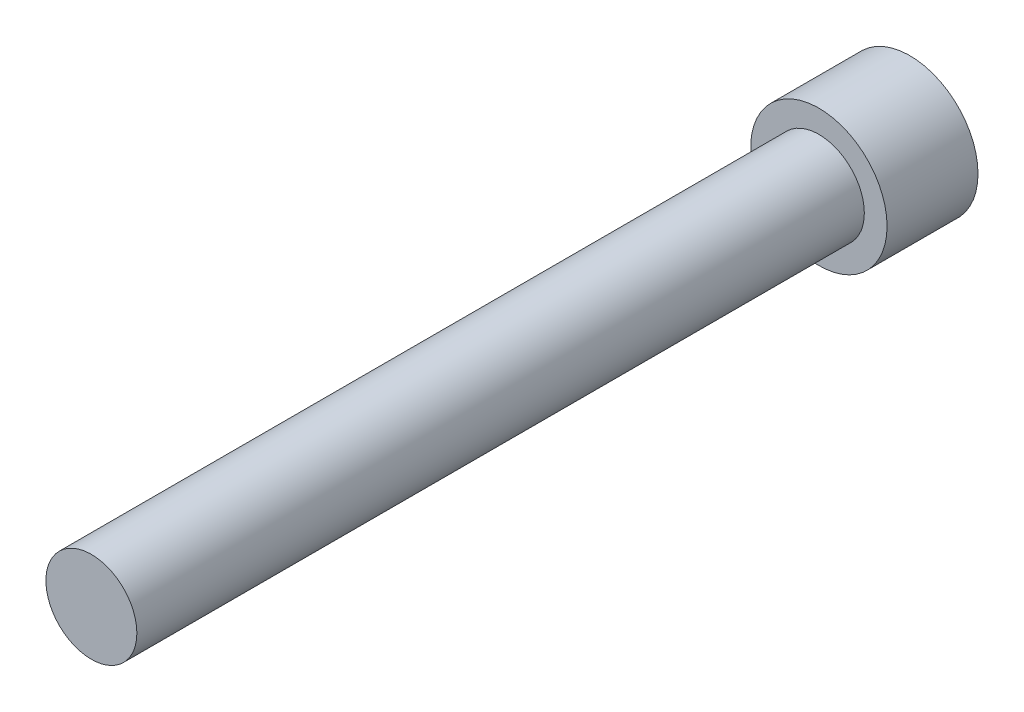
SolidWorks part; units mm, degrees
ref_plane "Front Plane" through (0, 0, 0) normal (0, 0, 1) x (1, 0, 0)
ref_plane "Top Plane" through (0, 0, 0) normal (0, 1, 0) x (1, 0, 0)
ref_plane "Right Plane" through (0, 0, 0) normal (1, 0, 0) x (0, 0, -1)
sketch "Sketch6" plane through (0, 0, 0) normal (1, 0, 0) x (0, 0, -1)
  line L0 (-50.8, 0) -> (22.525, 0) construction
  line L1 (5.2388, 0) -> (-5.2388, 0) construction
  line L2 (-50.8, 0) -> (-50.8, -3.175)
  line L3 (-50.8, -3.175) -> (0, -3.175)
  line L4 (0, 5.2388) -> (0, -5.2388) construction
  line L5 (0, -3.175) -> (0, -4.7625)
  line L6 (0, -4.7625) -> (6.35, -4.7625)
  line L7 (6.35, -4.7625) -> (6.35, 0)
  line L8 (6.35, 0) -> (-50.8, 0)
  dimension "L" = 50.8
  dimension "H" = 6.35
  dimension "A" = 9.525
  dimension "D" = 6.35
revolve "Revolve1" add sketch "Sketch6" angle 360 about L0
sketch "Sketch7" plane through (0, 0, -6.35) normal (0, 0, -1) x (-1, 0, 0)
  line L2 (-2.3876, 1.3785) -> (-2.3876, -1.3785)
  line L4 (-2.3876, -1.3785) -> (0, -2.757)
  line L5 (0, -2.757) -> (2.3876, -1.3785)
  line L6 (2.3876, -1.3785) -> (2.3876, 1.3785)
  line L7 (2.3876, 1.3785) -> (0, 2.757)
  line L8 (0, 2.757) -> (-2.3876, 1.3785)
  circle A0 centre (0, 0) radius 2.3876 construction
  dimension "J" = 4.7752
extrude "HEX" cut sketch "Sketch7" against normal blind 3.556
